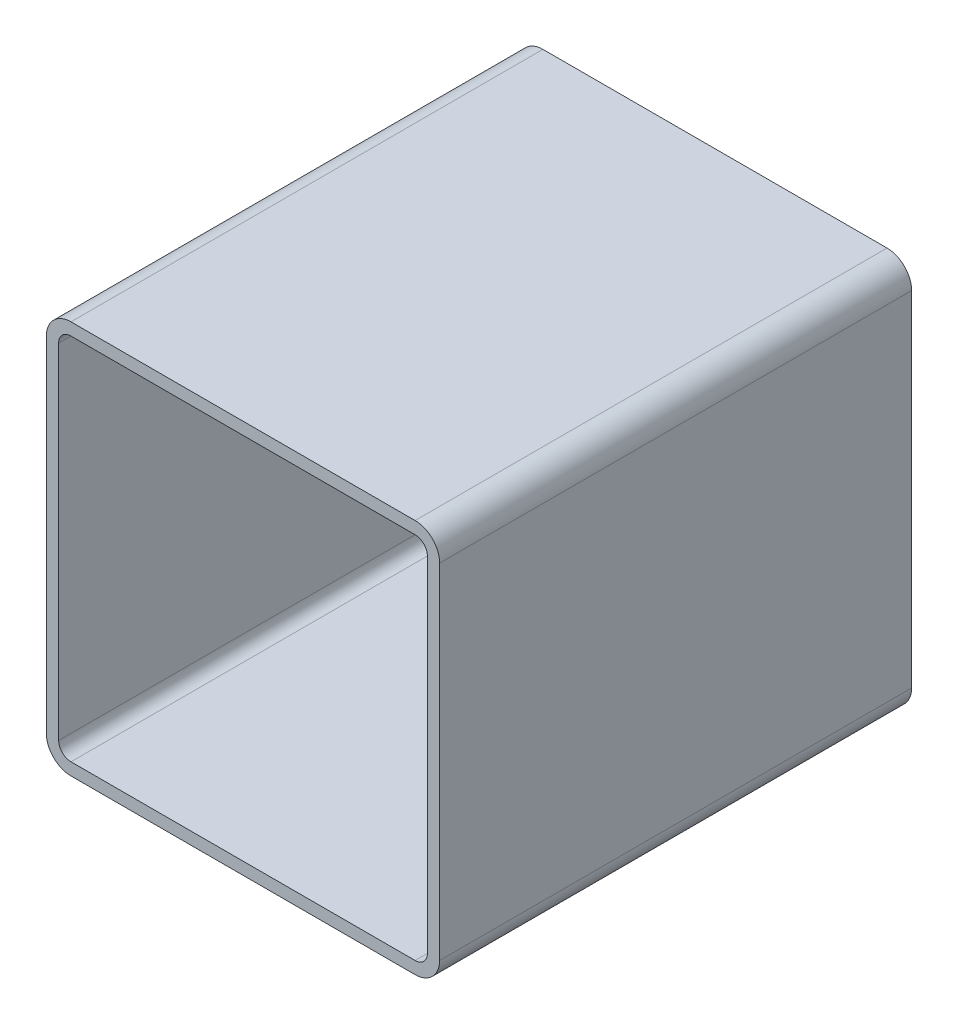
SolidWorks part; units mm, degrees
ref_plane "Front Plane" through (0, 0, 0) normal (0, 0, 1) x (1, 0, 0)
ref_plane "Top Plane" through (0, 0, 0) normal (0, 1, 0) x (1, 0, 0)
ref_plane "Right Plane" through (0, 0, 0) normal (1, 0, 0) x (0, 0, -1)
sketch "Sketch1" plane through (0, 0, 0) normal (0, 0, 1) x (1, 0, 0)
sketch_block_instance "HSS10x10x0.3125-1"
sketch_block "HSS10x10x0.3125"
extrude "Boss-Extrude1" add sketch "Sketch1" along normal blind 304.8
